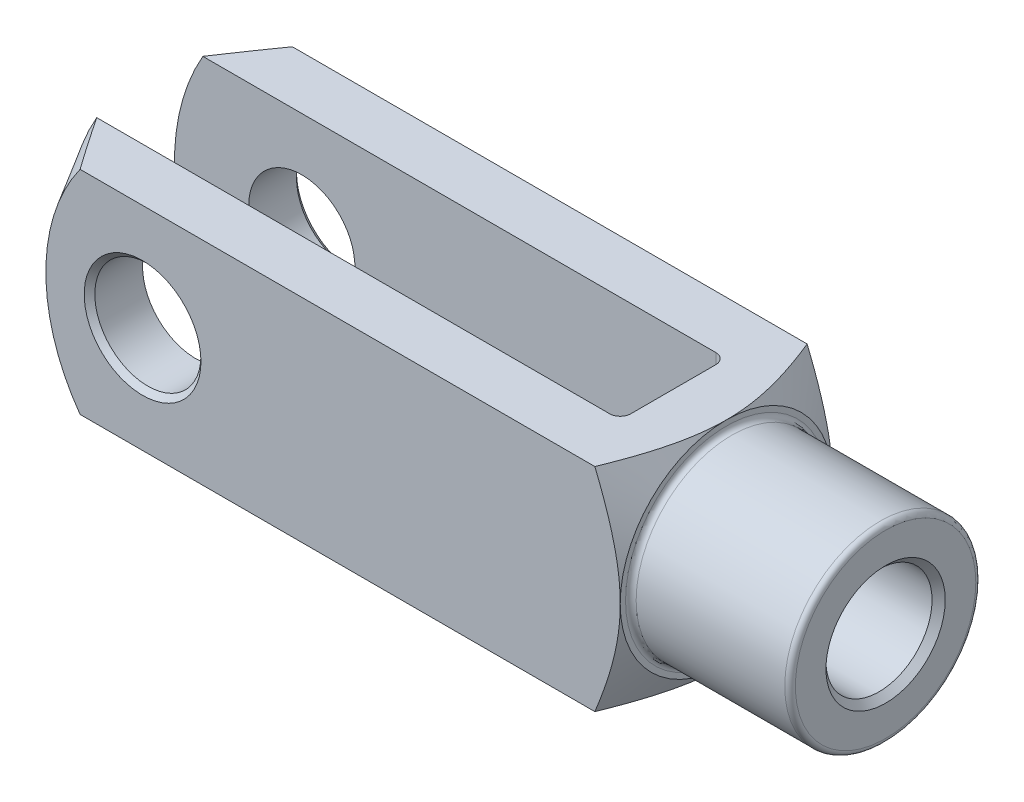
SolidWorks part; units mm, degrees
ref_plane "Front Plane" through (0, 0, 0) normal (0, 0, 1) x (1, 0, 0)
ref_plane "Top Plane" through (0, 0, 0) normal (0, 1, 0) x (1, 0, 0)
ref_plane "Right Plane" through (0, 0, 0) normal (1, 0, 0) x (0, 0, -1)
sketch "Sketch1" plane through (0, 0, 0) normal (1, 0, 0) x (0, 0, -1)
  line L0 (0, 0) -> (0, 50000) construction
  line L1 (0, 0) -> (50000, 0) construction
  line L2 (-10, -10) -> (-10, 10)
  line L3 (-10, 10) -> (10, 10)
  line L4 (10, -10) -> (10, 10)
  line L5 (-10, -10) -> (10, -10)
  point P9 (0, 10)
  point P11 (10, 0)
  point P12 (-10, 0)
  dimension "D1" = 20
  dimension "D2" = 20
extrude "Extrude1" add sketch "Sketch1" against normal blind 72
sketch "Sketch2" plane through (0, 0, 0) normal (1, 0, 0) x (0, 0, -1)
  circle A0 centre (0, 0) radius 9
  circle A1 centre (0, 0) radius 18
  dimension "D1" = 18
  dimension "D2" = 36
extrude "Extrude2" cut sketch "Sketch2" against normal blind 15
sketch "Sketch3" plane through (0, 0, 10) normal (0, 0, 1) x (1, 0, 0)
  circle A0 centre (-60, 0) radius 5
  dimension "D1" = 10
  dimension "D2" = 60
extrude "Extrude3" cut sketch "Sketch3" against normal through all
sketch "Sketch4" plane through (0, 10, 0) normal (0, 1, 0) x (1, 0, 0)
  line L0 (0, 0) -> (-50000, 0) construction
  line L1 (-72, -5) -> (-72, 5)
  line L2 (-72, 10) -> (-72, -10) construction
  line L3 (-72, 5) -> (-20, 5)
  line L4 (-20, 5) -> (-20, -5)
  line L5 (-60, 10) -> (-60, -10) construction
  line L6 (-72, -5) -> (-20, -5)
  point P7 (-60, 0)
  point P13 (-20, 0)
  point P14 (-72, 0)
  dimension "D1" = 40
  dimension "D2" = 10
extrude "Extrude4" cut sketch "Sketch4" against normal through all
fillet "Fillet1" radius 1 2 edges at (-20, 0, 5) (-20, 0, -5)
fillet "Fillet2" radius 0.5 2 edges at (0, 0, -9) (-15, 0, -9)
chamfer "Chamfer2" distance 0.5 angle 45 2 edges at (-55, 0, -10) (-55, 0, 10)
sketch "Sketch6" plane through (0, 0, 0) normal (0, 0, 1) x (1, 0, 0)
  line L0 (-15, -10) -> (-15, -20)
  line L1 (-15, -20) -> (-20.7735, -20)
  line L2 (-20.7735, -20) -> (-15, -10)
  dimension "D1" = 30
  dimension "D2" = 20
revolve "Cut-Revolve1" cut sketch "Sketch6" angle 360 about axis through (-15, 0, 0) along (1, 0, 0)
sketch "Sketch7" plane through (0, 0, 0) normal (0, 1, 0) x (1, 0, 0)
  line L0 (-69.1132, -10) -> (-72, -5)
  line L1 (-72, 5) -> (-69.1132, 10)
  line L2 (-69.1132, 10) -> (-92, 10)
  line L3 (-72, 5) -> (-72, -5)
  line L4 (-92, 10) -> (-92, -10)
  line L5 (-92, -10) -> (-69.1132, -10)
  line L6 (-72, 10) -> (-17.3915, 10) construction
  line L7 (-72, -10) -> (-17.3915, -10) construction
  line L8 (-52, 0.6162) -> (-52, 50000.6162) construction
  dimension "D1" = 120
  dimension "D2" = 20
  dimension "D3" = 20
revolve "Cut-Revolve2" cut sketch "Sketch7" angle 180 about L8
sketch "Sketch8" plane through (0, 0, 0) normal (1, 0, 0) x (0, 0, -1)
  circle A0 centre (0, 0) radius 5
  dimension "D1" = 10
extrude "Extrude5" cut sketch "Sketch8" against normal through all
chamfer "Chamfer3" distance 0.62 angle 45 1 edges at (0, 0, -5)
equation "\"D2@Sketch1\" = \"D1@Sketch1\""
equation "\"D2@Sketch2\" = \"D1@Sketch2\"*2"
equation "\"D2@Sketch6\" = \"D1@Sketch1\""
equation "\"D2@Sketch7\" = \"D1@Sketch1\""
equation "\"D3@Sketch7\" = \"D1@Sketch1\""
